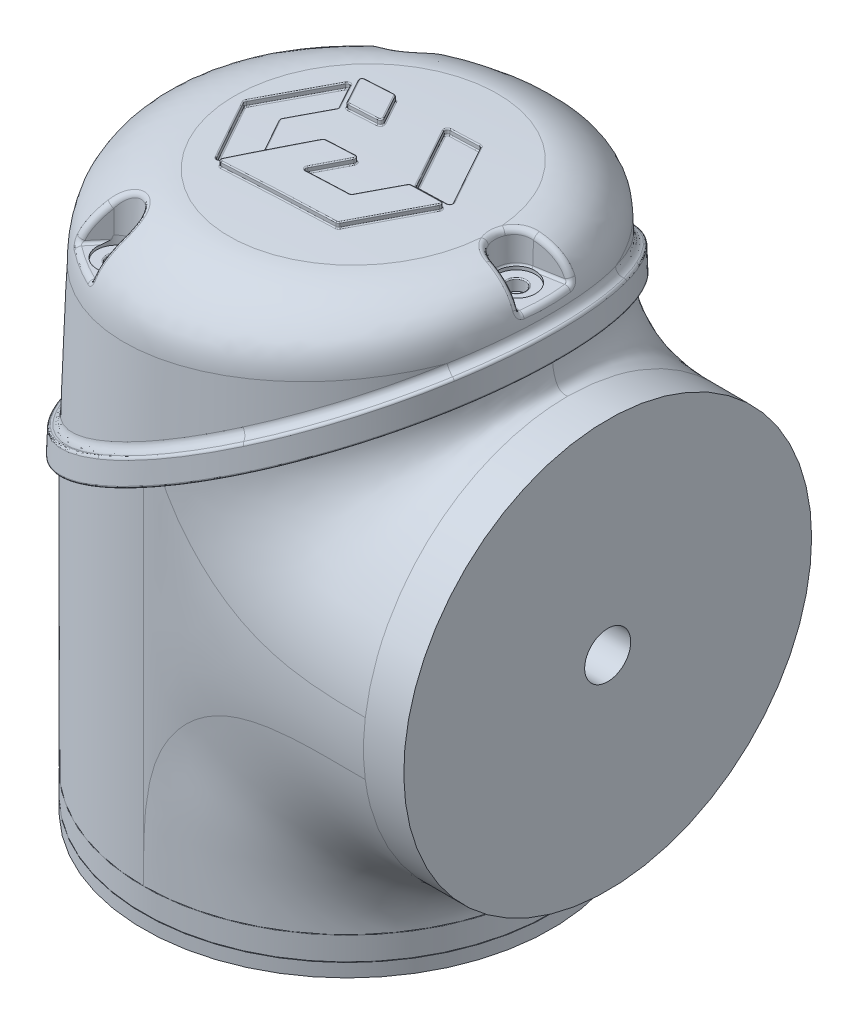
SolidWorks part; units mm, degrees
ref_plane "前视基准面" through (0, 0, 0) normal (0, 0, 1) x (1, 0, 0)
ref_plane "上视基准面" through (0, 0, 0) normal (0, 1, 0) x (1, 0, 0)
ref_plane "右视基准面" through (0, 0, 0) normal (1, 0, 0) x (0, 0, -1)
imported_body "ERJ-14关节-固定部分-1/ELITE040060-004(II)小关节-1-solid1"
imported_body "ERJ-14关节-固定部分-1/ELITE040060-020小关节过度环-1-solid1"
imported_body "ERJ-14关节-固定部分-1/17001050006--ELITE040060-021-小关节橡胶圈-1-solid1"
imported_body "ERJ-14关节-固定部分-1/14关节后盖-EC-1-solid1"
sketch "草图1" plane through (0, 26.6729, 0) normal (0, -1, 0) x (1, 0, 0)
  circle A0 centre (46.2462, 0) radius 37
  dimension "D1" = 74
extrude "凸台-拉伸1" add sketch "草图1" against normal blind 70
sketch "草图2" plane through (94.7462, 0, 0) normal (1, 0, 0) x (0, 0, -1)
  circle A0 centre (0, 76.1729) radius 36.5
  dimension "D1" = 73
extrude "凸台-拉伸2" add sketch "草图2" against normal blind 50
sketch "草图4" plane through (94.7462, 0, 0) normal (1, 0, 0) x (0, 0, -1)
  circle A0 centre (0, 76.1729) radius 4.2907
extrude "切除-拉伸1" cut sketch "草图4" against normal blind 10
sketch "草图5" plane through (0, 26.6729, 0) normal (0, -1, 0) x (1, 0, 0)
  circle A0 centre (46.2462, 0) radius 4.3845
extrude "切除-拉伸2" cut sketch "草图5" against normal blind 10
surface "曲面填充1"
surface "曲面填充2"
surface "曲面填充3"
sketch "草图6" plane through (0, 0, 0) normal (1, 0, 0) x (0, 0, -1)
  circle A0 centre (-54.0293, 79.9936) radius 120.4684
extrude "凸台-拉伸3" add sketch "草图6" along normal blind 120 separate body
other "相交1"
delete or keep bodies "实体-删除/保留 1" type delete bodies bodies 114 115 116
